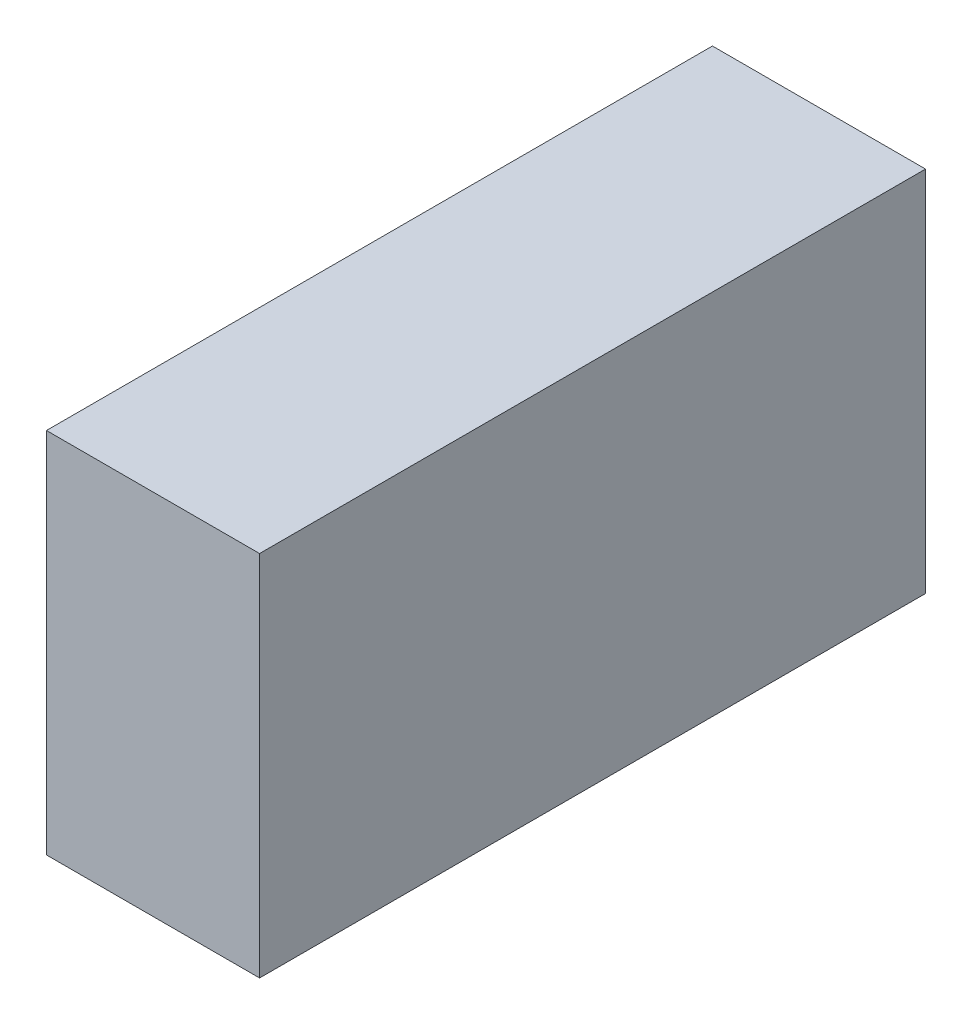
SolidWorks part; units mm, degrees
ref_plane "Face" through (0, 0, 0) normal (0, 0, 1) x (1, 0, 0)
ref_plane "Dessus" through (0, 0, 0) normal (0, 1, 0) x (1, 0, 0)
ref_plane "Droite" through (0, 0, 0) normal (1, 0, 0) x (0, 0, -1)
sketch "Esquisse1" plane through (0, 0, 0) normal (0, 0, 1) x (1, 0, 0)
  line L1 (0, 0) -> (8, 0)
  line L2 (0, 0) -> (0, 13.8)
  line L3 (0, 13.8) -> (8, 13.8)
  line L4 (8, 0) -> (8, 13.8)
  dimension "D1" = 13.8
  dimension "D2" = 8
extrude "Extrusion1" add sketch "Esquisse1" along normal blind 25
